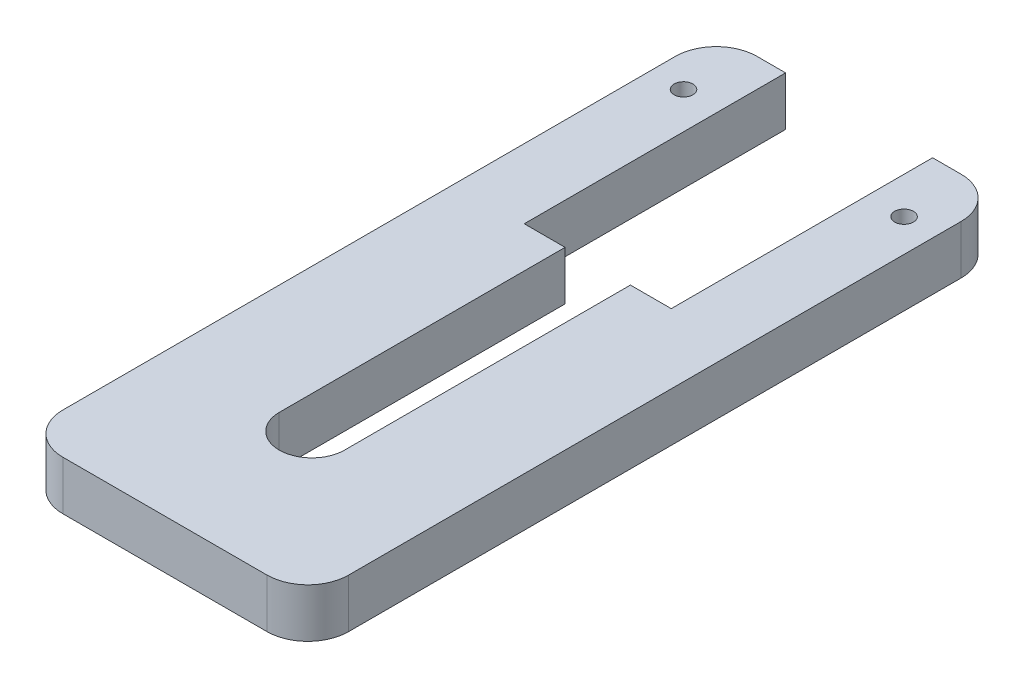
SolidWorks part; units mm, degrees
ref_plane "Ebene vorne" through (0, 0, 0) normal (0, 0, 1) x (1, 0, 0)
ref_plane "Ebene oben" through (0, 0, 0) normal (0, 1, 0) x (1, 0, 0)
ref_plane "Ebene rechts" through (0, 0, 0) normal (1, 0, 0) x (0, 0, -1)
sketch "Skizze1" plane through (0, 0, 0) normal (0, 1, 0) x (1, 0, 0)
  line L0 (0, 96.6814) -> (0, -11.5559) construction
  line L1 (4, 53) -> (9, 53)
  line L2 (-9, 85) -> (-9, 53)
  line L3 (-17.5, 80) -> (-17.5, 5)
  line L4 (-12.5, 0) -> (12.5, 0)
  line L5 (17.5, 80) -> (17.5, 5)
  line L7 (-4, 53) -> (-4, 18)
  line L8 (-12.5, 85) -> (-9, 85)
  line L10 (4, 53) -> (4, 18)
  line L11 (-9, 53) -> (-4, 53)
  line L12 (12.5, 85) -> (9, 85)
  line L13 (9, 85) -> (9, 53)
  arc A0 (-4, 18) -> (4, 18) centre (0, 18) ccw
  arc A1 (-17.5, 5) -> (-12.5, 0) centre (-12.5, 5) ccw
  arc A2 (12.5, 0) -> (17.5, 5) centre (12.5, 5) ccw
  arc A3 (17.5, 80) -> (12.5, 85) centre (12.5, 80) ccw
  arc A4 (-12.5, 85) -> (-17.5, 80) centre (-12.5, 80) ccw
  circle A5 centre (-13.5, 77) radius 1.15
  circle A6 centre (13.5, 77) radius 1.15
  point P13 (17.5, 0)
  point P35 (0, 0)
  dimension "D6" = 35
  dimension "D3" = 5
  dimension "D8" = 2.3
  dimension "D1" = 85
  dimension "D2" = 35
  dimension "D4" = 18
  dimension "D5" = 32
  dimension "D7" = 8
  dimension "D9" = 4
  dimension "D10" = 8
extrude "Aufsatz-Linear austragen1" add sketch "Skizze1" along normal blind 6
